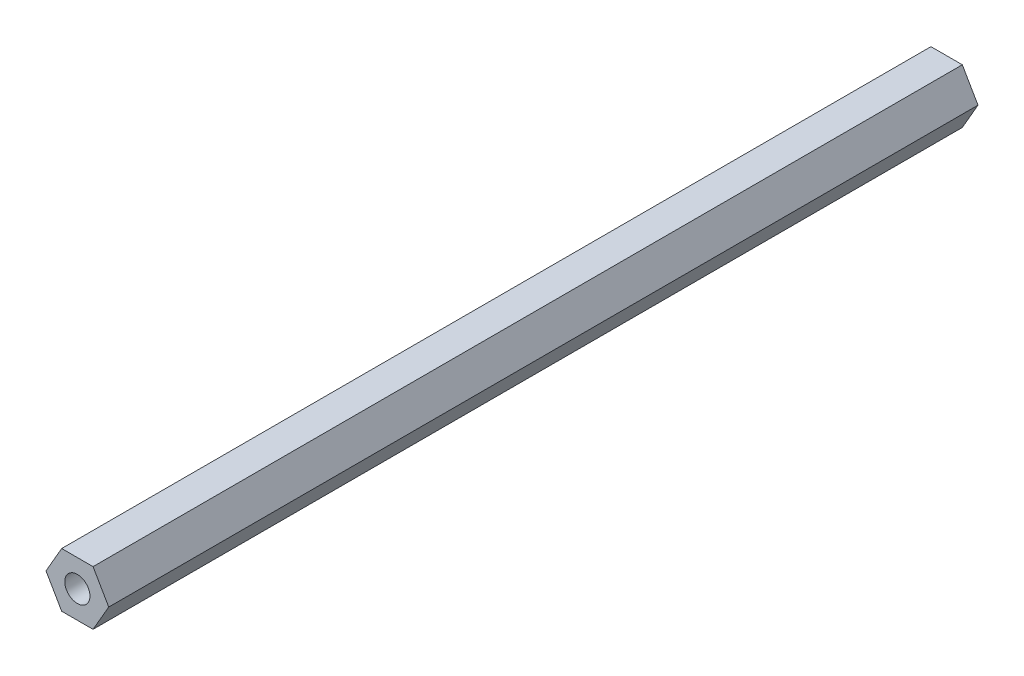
SolidWorks part; units mm, degrees
ref_plane "Front Plane" through (0, 0, 0) normal (0, 0, 1) x (1, 0, 0)
ref_plane "Top Plane" through (0, 0, 0) normal (0, 1, 0) x (1, 0, 0)
ref_plane "Right Plane" through (0, 0, 0) normal (1, 0, 0) x (0, 0, -1)
sketch "Sketch1" plane through (0, 0, 0) normal (0, 0, 1) x (1, 0, 0)
  line L1 (1.8331, 3.175) -> (-1.8331, 3.175)
  line L2 (-1.8331, 3.175) -> (-3.6662, 0)
  line L3 (-3.6662, 0) -> (-1.8331, -3.175)
  line L4 (-1.8331, -3.175) -> (1.8331, -3.175)
  line L5 (1.8331, -3.175) -> (3.6662, 0)
  line L6 (3.6662, 0) -> (1.8331, 3.175)
  circle A0 centre (0, 0) radius 3.175 construction
  dimension "D1" = 6.35
extrude "Boss-Extrude1" add sketch "Sketch1" along normal blind 101.6
hole_wizard "#4 Clearance Hole1" positions "Sketch3" profile "Sketch2" hole size "#4" standard "ANSI Inch"
sketch "Sketch3" plane through (0, 0, 101.6) normal (0, 0, 1) x (1, 0, 0)
  point P0 (0, 0)
sketch "Sketch2" plane through (0, 0, 101.6) normal (1, 0, 0) x (0, -1, 0)
  line L0 (0, 0) -> (0, 101.6)
  line L1 (0, 101.6) -> (1.4732, 101.6)
  line L2 (1.4732, 101.6) -> (1.4732, 0)
  line L5 (1.4732, 0) -> (0, 0)
  line L11 (0, -6.35) -> (0, 107.95) construction
  dimension "Thru Hole Dia." = 2.9464
  dimension "Thru Hole Depth" = 101.6
